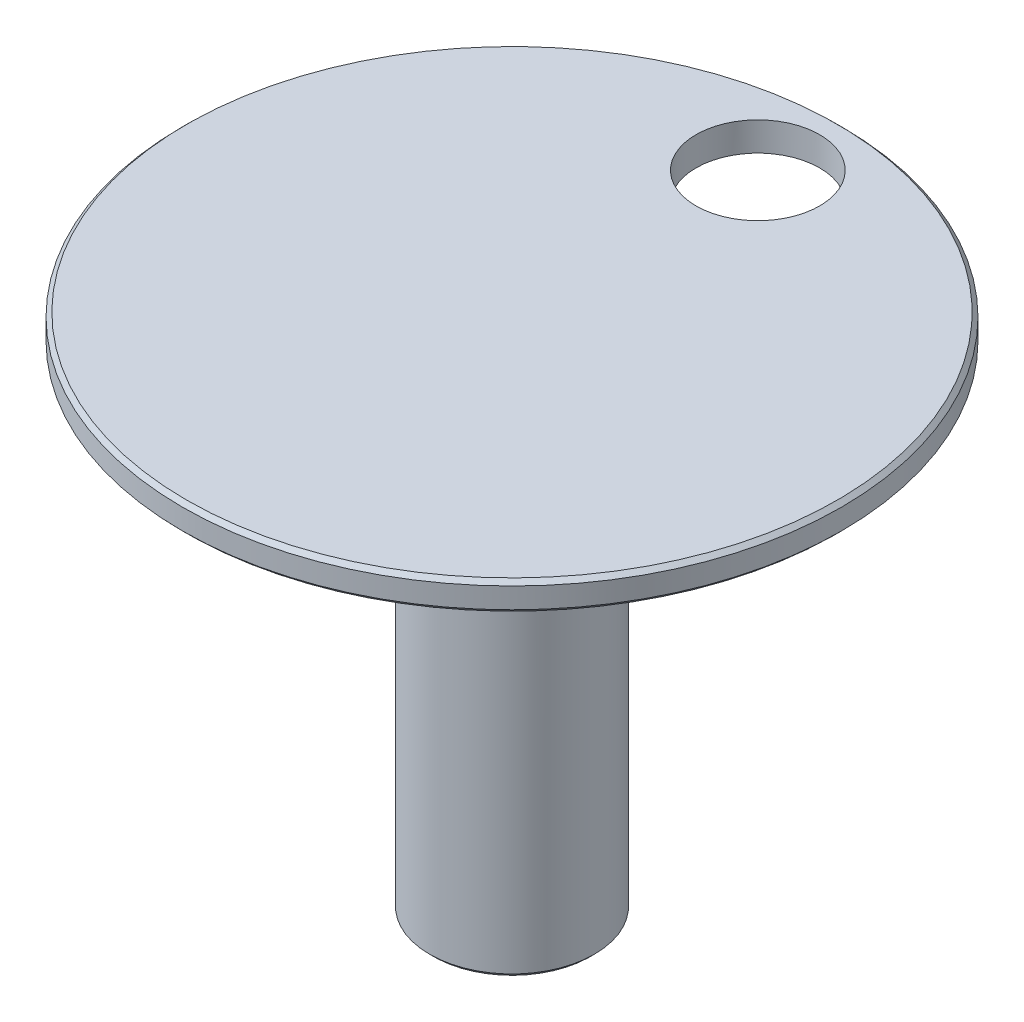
SolidWorks part; units mm, degrees
ref_plane "Front Plane" through (0, 0, 0) normal (0, 0, 1) x (1, 0, 0)
ref_plane "Top Plane" through (0, 0, 0) normal (0, 1, 0) x (1, 0, 0)
ref_plane "Right Plane" through (0, 0, 0) normal (1, 0, 0) x (0, 0, -1)
sketch "Sketch1" plane through (0, 0, 0) normal (0, 0, 1) x (1, 0, 0)
  line L0 (0, 0) -> (0, -5698.2538) construction
  line L1 (0, 0) -> (5698.2538, 0) construction
  line L2 (0, 7.4863) -> (-8, 7.4863)
  line L3 (-8, 7.4863) -> (-8, 6.7863)
  line L4 (-8, 6.7863) -> (-4, 6.7863)
  line L5 (-4, 6.7863) -> (-4, 6.4863)
  line L6 (-4, 6.4863) -> (-2, 6.4863)
  line L7 (-2, 6.4863) -> (-2, -5.1137)
  line L8 (-2, -5.1137) -> (0, -5.1137)
  line L9 (0, 7.4863) -> (0, -5.1137)
  dimension "D1" = 16
  dimension "D2" = 8
  dimension "D3" = 0.7
  dimension "D4" = 0.3
  dimension "D5" = 11.6
  dimension "D6" = 4
revolve "Revolve1" add sketch "Sketch1" angle 360 about L0
sketch "Sketch2" plane through (0, 7.4863, 0) normal (0, 1, 0) x (1, 0, 0)
  circle A0 centre (0, 5.9688) radius 1.5
  dimension "D1" = 3
extrude "Cut-Extrude1" cut sketch "Sketch2" against normal blind 10
sketch "Sketch3" plane through (0, -5.1137, 0) normal (0, -1, 0) x (1, 0, 0)
  circle A0 centre (0, 0) radius 1.5
  dimension "D1" = 3
extrude "Cut-Extrude2" cut sketch "Sketch3" against normal blind 8.5
chamfer "Chamfer1" distance 0.1 angle 45 3 edges at (0, -5.1137, 2) (0, 6.7863, 8) (0, 7.4863, 8)
